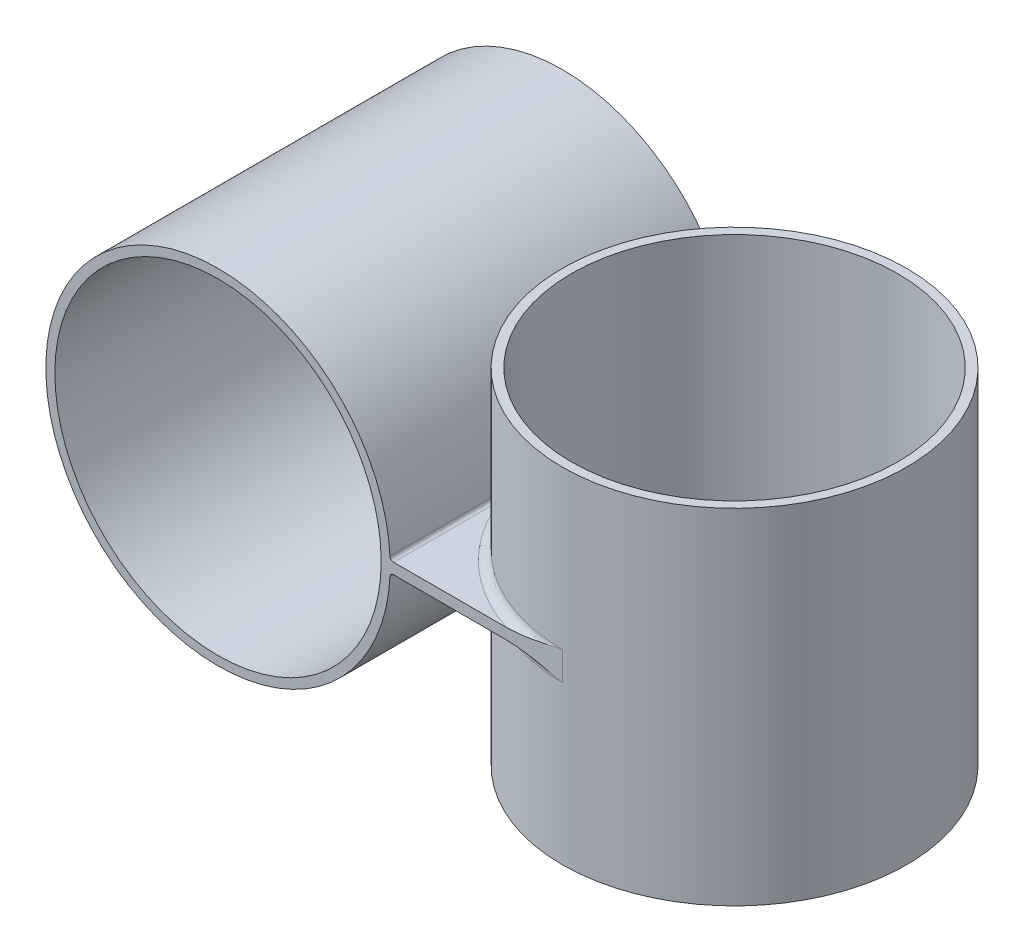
SolidWorks part; units mm, degrees
ref_plane "Front Plane" through (0, 0, 0) normal (0, 0, 1) x (1, 0, 0)
ref_plane "Top Plane" through (0, 0, 0) normal (0, 1, 0) x (1, 0, 0)
ref_plane "Right Plane" through (0, 0, 0) normal (1, 0, 0) x (0, 0, -1)
sketch "Sketch1" plane through (0, 0, 0) normal (0, 1, 0) x (1, 0, 0)
  circle A0 centre (0, 0) radius 95.5
  circle A1 centre (0, 0) radius 90.5
  dimension "D1" = 191
  dimension "D2" = 5
extrude "Boss-Extrude1" add sketch "Sketch1" along normal mid plane 191
sketch "Sketch2" plane through (0, 0, 0) normal (0, 0, 1) x (1, 0, 0)
  line L0 (0, 0) -> (-62.7998, 0) construction
  circle A0 centre (-191, 0) radius 95.5
  circle A1 centre (-191, 0) radius 90.5
  point P7 (-37.8646, 0)
  dimension "D1" = 191
  dimension "D3" = 191
  dimension "D2" = 5
extrude "Boss-Extrude2" add sketch "Sketch2" along normal mid plane 191 separate body
sketch "Sketch3" plane through (0, 0, 0) normal (0, 1, 0) x (1, 0, 0)
  line L1 (-95.5, -95.5) -> (-95.5, 0)
  line L2 (-95.5, -95.5) -> (0, -95.5)
  circle A0 centre (0, 0) radius 95.5 construction
  arc A1 (-95.5, 0) -> (0, -95.5) centre (0, 0) ccw
  point P2 (0, 0)
  point P6 (-95.5, -50)
extrude "Boss-Extrude3" add sketch "Sketch3" along normal mid plane 6
mirror "Mirror4" about plane through (0, 0, 0) normal (0, 0, 1) of "Boss-Extrude3"
fillet "Fillet1" radius 5 4 edges at (-67.5287, 3, 67.5287) (-67.5287, -3, 67.5287) (-67.5287, 3, -67.5287) (-67.5287, -3, -67.5287)
sketch "Sketch4" plane through (-95.5, 0, 0) normal (-1, 0, 0) x (0, 0, 1)
  line L4 (0, 3) -> (-31.305, 3)
  line L5 (31.305, -3) -> (95.5, -3)
  line L6 (95.5, -3) -> (95.5, 3)
  line L7 (95.5, 3) -> (31.305, 3)
  line L9 (31.305, -3) -> (95.5, -3)
  line L10 (95.5, -3) -> (95.5, 3)
  line L11 (95.5, 3) -> (31.305, 3)
  line L20 (0, 3) -> (-31.305, 3)
  line L21 (-31.305, 3) -> (-95.5, 3)
  line L22 (-31.305, 3) -> (-95.5, 3)
  line L23 (-95.5, 3) -> (-95.5, -3)
  line L24 (-95.5, 3) -> (-95.5, -3)
  line L25 (-95.5, -3) -> (-31.305, -3)
  line L26 (-95.5, -3) -> (-31.305, -3)
  line L27 (-31.305, -3) -> (0, -3)
  line L28 (-31.305, -3) -> (0, -3)
  spline S2 degree 1 poles (-2999.9648, -3) (3031.2752, -3) knots -95.83036 -95.83036 96.830533 96.830533 only from (0, -3) to (31.305, -3)
  spline S3 degree 1 poles (0, -3) (31.305, -3) knots 0 0 1 1
  spline S4 degree 1 poles (3031.2697, 3) (-2999.9702, 3) knots -95.83036 -95.83036 96.830533 96.830533 only from (31.305, 3) to (0, 3)
  spline S5 degree 1 poles (31.305, 3) (0, 3) knots 0 0 1 1
  dimension "D1" = 0
extrude "Boss-Extrude4" add sketch "Sketch4" along normal up to body separate body
fillet "Fillet2" radius 2 2 edges at (-95.5471, -3, 0) (-95.5471, 3, 0)
